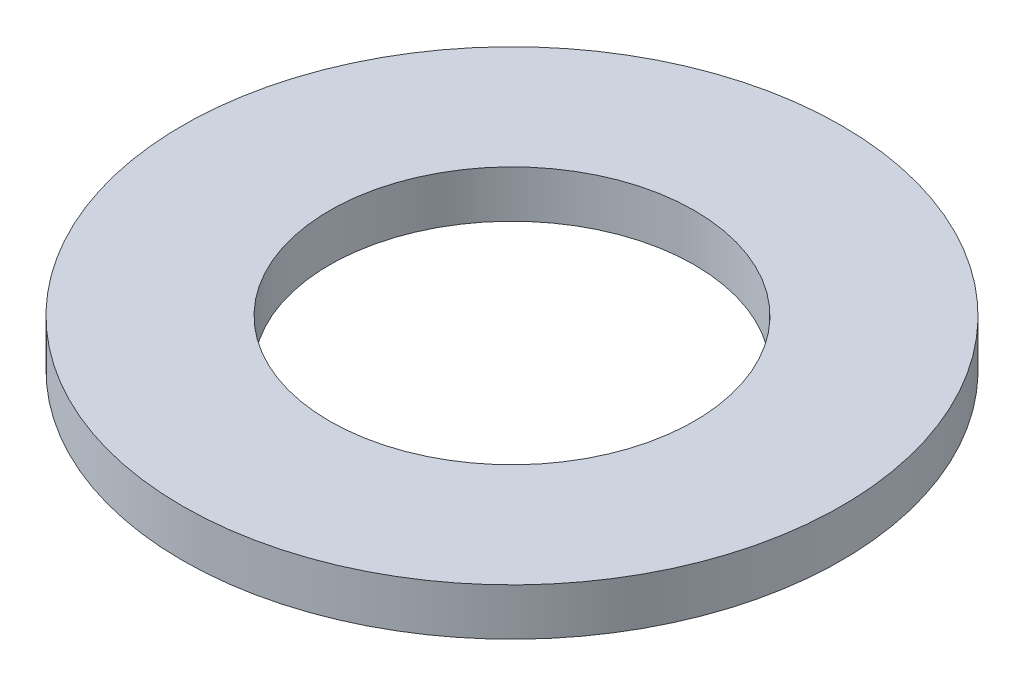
SolidWorks part; units mm, degrees
ref_plane "Front" through (0, 0, 0) normal (0, 0, 1) x (1, 0, 0)
ref_plane "Top" through (0, 0, 0) normal (0, 1, 0) x (1, 0, 0)
ref_plane "Right" through (0, 0, 0) normal (1, 0, 0) x (0, 0, -1)
sketch "Sketch1" plane through (0, 0, 0) normal (0, 1, 0) x (1, 0, 0)
  circle A0 centre (0, 0) radius 15.5
  circle A1 centre (0, 0) radius 28
extrude "Extrude1" add sketch "Sketch1" along normal blind 4
